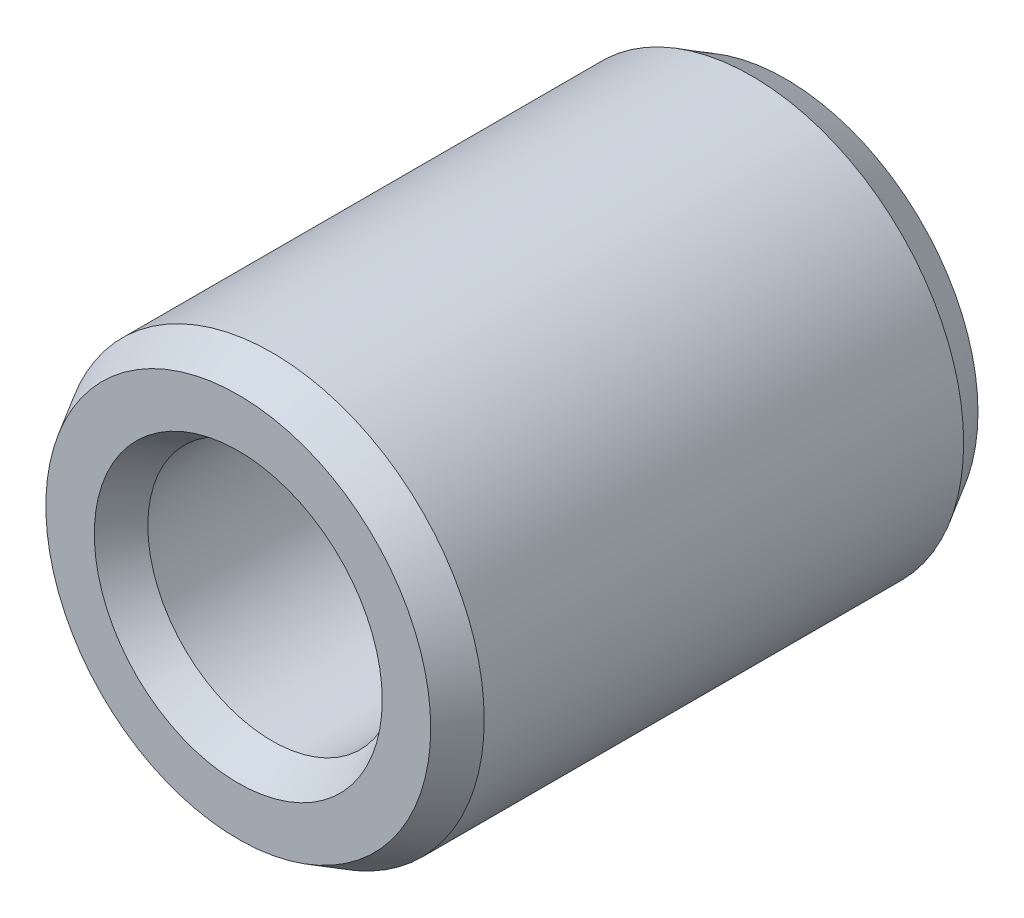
SolidWorks part; units mm, degrees
ref_plane "Plane1" through (0, 0, 0) normal (0, 0, 1) x (1, 0, 0)
ref_plane "Plane2" through (0, 0, 0) normal (0, 1, 0) x (1, 0, 0)
ref_plane "Plane3" through (0, 0, 0) normal (1, 0, 0) x (0, 0, -1)
sketch "Sketch1" plane through (0, 0, 0) normal (0, 0, 1) x (1, 0, 0)
  circle A0 centre (0, 0) radius 4.7625
  circle A1 centre (0, 0) radius 2.794
  dimension "D1" = 5.588
  dimension "D2" = 9.525
extrude "Base-Extrude" add sketch "Sketch1" along normal blind 12.2936
chamfer "Chamfer2" distance 0.762 angle 30
